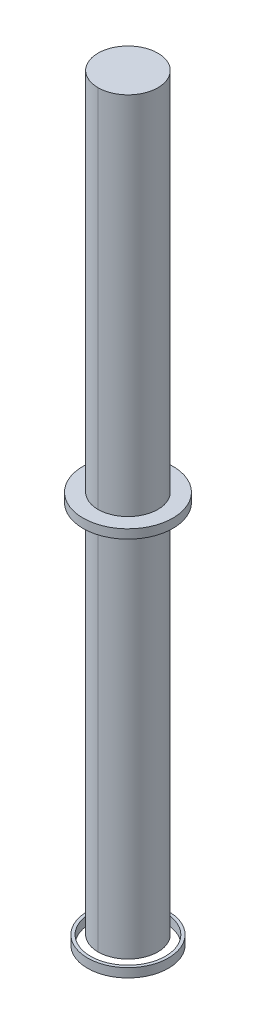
SolidWorks part; units mm, degrees
ref_plane "Front Plane" through (0, 0, 0) normal (0, 0, 1) x (1, 0, 0)
ref_plane "Top Plane" through (0, 0, 0) normal (0, 1, 0) x (1, 0, 0)
ref_plane "Right Plane" through (0, 0, 0) normal (1, 0, 0) x (0, 0, -1)
sketch "Sketch1" plane through (0, 0, 0) normal (0, 1, 0) x (1, 0, 0)
  circle A0 centre (0, 0) radius 2
  dimension "D1" = 4
extrude "Boss-Extrude1" add sketch "Sketch1" along normal blind 50
sketch "Sketch5" plane through (0, 0, 0) normal (0, 1, 0) x (1, 0, 0)
  circle A0 centre (0, 0) radius 2.5
  circle A1 centre (0, 0) radius 2.7
  dimension "D1" = 0.2
extrude "Boss-Extrude4" add sketch "Sketch5" against normal blind 0.6 separate body
ref_plane "Plane1" through (0, 25, 0) normal (0, 1, 0) x (1, 0, 0)
sketch "Sketch6" plane through (0, 25, 0) normal (0, 1, 0) x (1, 0, 0)
  circle A1 centre (0, 0) radius 2
  circle A3 centre (0, 0) radius 3
  dimension "D1" = 6
  dimension "D2" = 4
extrude "Boss-Extrude5" add sketch "Sketch6" along normal blind 0.6
sketch "Sketch9" plane through (0, 0, 0) normal (0, 0, 1) x (1, 0, 0)
  line L0 (0, 50) -> (0, 0)
  line L1 (2, 50) -> (-2, 50) construction
